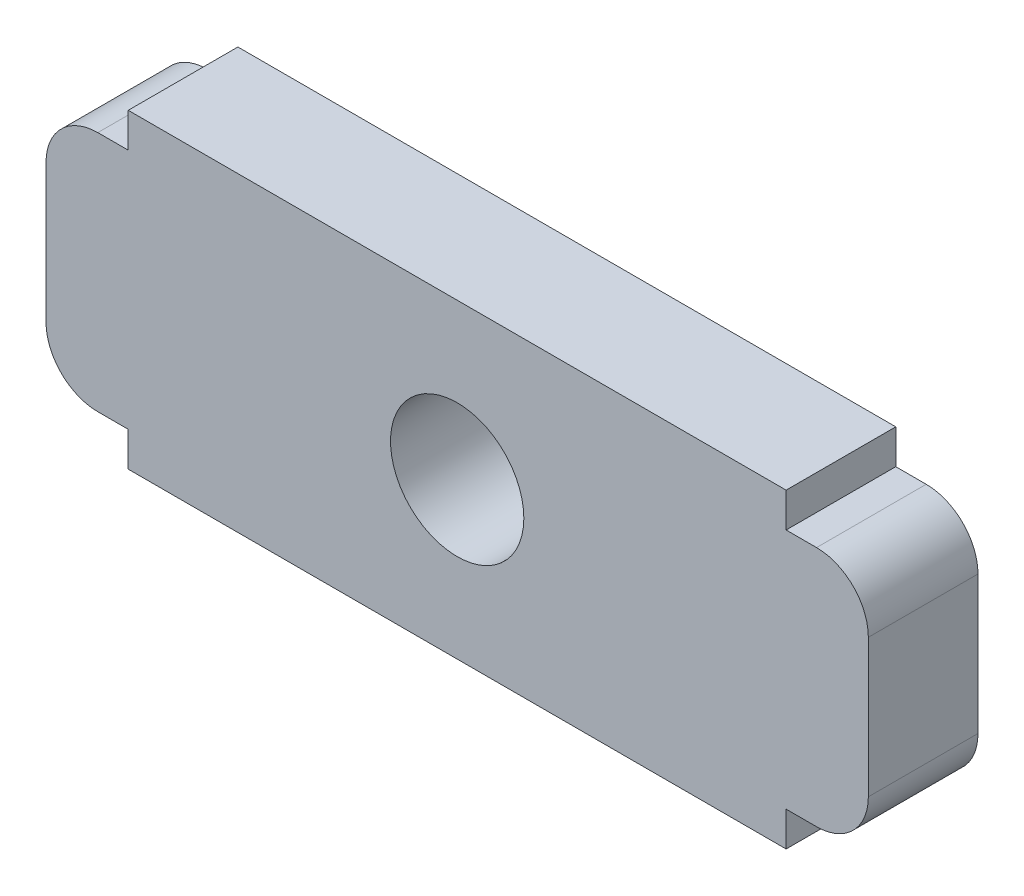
SolidWorks part; units mm, degrees
ref_plane "Front Plane" through (0, 0, 0) normal (0, 0, 1) x (1, 0, 0)
ref_plane "Top Plane" through (0, 0, 0) normal (0, 1, 0) x (1, 0, 0)
ref_plane "Right Plane" through (0, 0, 0) normal (1, 0, 0) x (0, 0, -1)
sketch "Sketch1" plane through (0, 0, 0) normal (0, 0, 1) x (1, 0, 0)
  line L0 (-9.525, 4.5) -> (-9.525, 3.5)
  line L1 (-9.525, -4.5) -> (9.525, -4.5)
  line L2 (-9.525, -4.5) -> (-9.525, 4.5) construction
  line L3 (-9.525, 4.5) -> (9.525, 4.5)
  line L4 (9.525, -4.5) -> (9.525, 4.5) construction
  line L5 (-9.525, -4.5) -> (9.525, 4.5) construction
  line L6 (-9.525, 4.5) -> (9.525, -4.5) construction
  line L7 (-9.525, 3.5) -> (-11.9063, 3.5)
  line L8 (-11.9063, 3.5) -> (-11.9063, -3.5)
  line L9 (-11.9063, -3.5) -> (-9.525, -3.5)
  line L10 (-9.525, -3.5) -> (-9.525, -4.5)
  line L11 (0, 0) -> (0, -4.5) construction
  line L12 (9.525, -3.5) -> (9.525, -4.5)
  line L13 (11.9063, -3.5) -> (9.525, -3.5)
  line L14 (11.9063, 3.5) -> (11.9063, -3.5)
  line L15 (9.525, 3.5) -> (11.9063, 3.5)
  line L16 (9.525, 4.5) -> (9.525, 3.5)
  circle A0 centre (0, 0) radius 1.9304
  point P0 (0, 0)
  dimension "D4" = 3.8608
  dimension "D1" = 19.05
  dimension "D2" = 9
  dimension "D3" = 7
  dimension "D5" = 2.3813
extrude "Boss-Extrude1" add sketch "Sketch1" along normal blind 3.175
fillet "Fillet1" radius 1.5 4 edges at (11.9063, 3.5, 1.5875) (11.9063, -3.5, 1.5875) (-11.9063, -3.5, 1.5875) (-11.9063, 3.5, 1.5875)
other "Move Face1" [suppressed] parameters "D1"=0.0762
